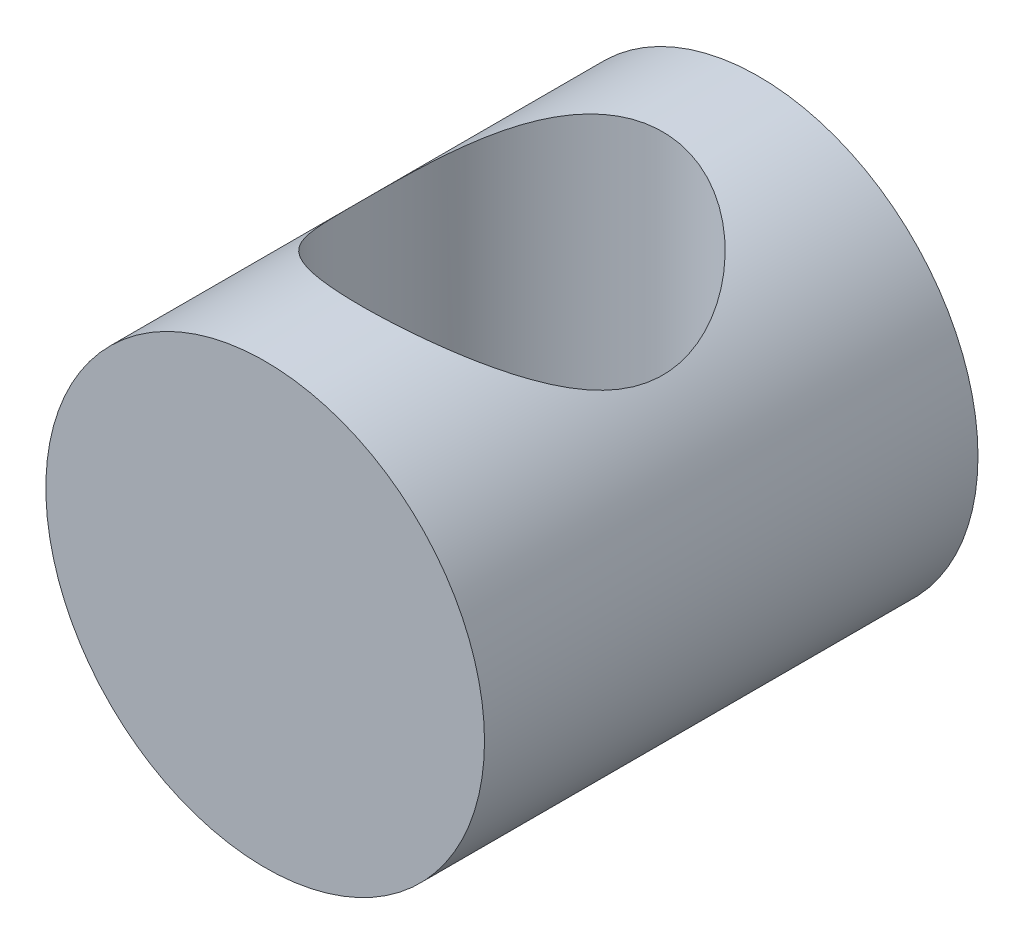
SolidWorks part; units mm, degrees
ref_plane "前视基准面" through (0, 0, 0) normal (0, 0, 1) x (1, 0, 0)
ref_plane "上视基准面" through (0, 0, 0) normal (0, 1, 0) x (1, 0, 0)
ref_plane "右视基准面" through (0, 0, 0) normal (1, 0, 0) x (0, 0, -1)
sketch "草图1" plane through (0, 0, 0) normal (0, 0, 1) x (0, -1, 0)
  circle A0 centre (0, 0) radius 8
  dimension "D1" = 16
extrude "凸台-拉伸1" add sketch "草图1" along normal blind 18
sketch "草图3" plane through (0, 0, 0) normal (0, 1, 0) x (1, 0, 0)
  line L0 (0, -2.914) -> (0, -15.086) construction
  line L1 (-6.0116, -9) -> (5.0593, -9) construction
  circle A0 centre (0, -9) radius 5.5
  dimension "D1" = 11
extrude "切除-拉伸1" cut sketch "草图3" against normal mid plane 20
